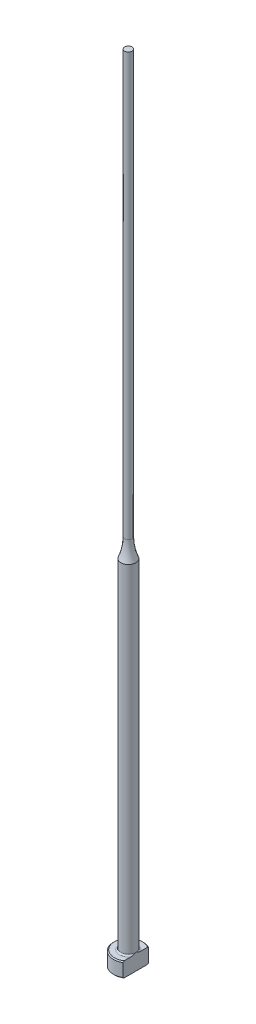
SolidWorks part; units mm, degrees
ref_plane "Front Plane" through (0, 0, 0) normal (0, 0, 1) x (1, 0, 0)
ref_plane "Top Plane" through (0, 0, 0) normal (0, 1, 0) x (1, 0, 0)
ref_plane "Right Plane" through (0, 0, 0) normal (1, 0, 0) x (0, 0, -1)
sketch "Sketch1" plane through (0, 0, 0) normal (0, 0, 1) x (1, 0, 0)
  line L0 (0, 259.9588) -> (0, -15.1925) construction
  line L1 (0, 0) -> (-3, 0)
  line L2 (-3, 0) -> (-3, 3)
  line L3 (-3, 3) -> (-1.5, 3)
  line L4 (-0.75, 75) -> (-0.75, 160)
  line L5 (-0.75, 160) -> (0, 160)
  line L6 (0, 160) -> (0, 0)
  line L7 (-1.5, 3) -> (-1.5, 71.2003)
  arc A0 (-1.5, 71.2003) -> (-0.75, 75) centre (-10.75, 75) ccw
  point P13 (-1.5, 0)
  dimension "D1" = 10
  dimension "L" = 160
  dimension "H" = 6
  dimension "T" = 3
  dimension "D" = 1.5
  dimension "B" = 3
  dimension "S" = 75
revolve "Revolve1" add sketch "Sketch1" angle 360 about L0
chamfer "Chamfer1" distance 0.2 angle 45 2 edges at (0, 3, 3) (0, 0, 3)
fillet "Fillet1" radius 0.3 1 edges at (0, 3, 1.5)
sketch "Sketch2" plane through (0, 0, 0) normal (0, 1, 0) x (1, 0, 0)
  line L0 (1.5, 2.5981) -> (1.5, -2.5981)
  circle A0 centre (0, 0) radius 3 construction
  arc A1 (1.5, -2.5981) -> (1.5, 2.5981) centre (0, 0) ccw
  circle A2 centre (0, 0) radius 1.5 construction
extrude "KEY" cut sketch "Sketch2" along normal through all
